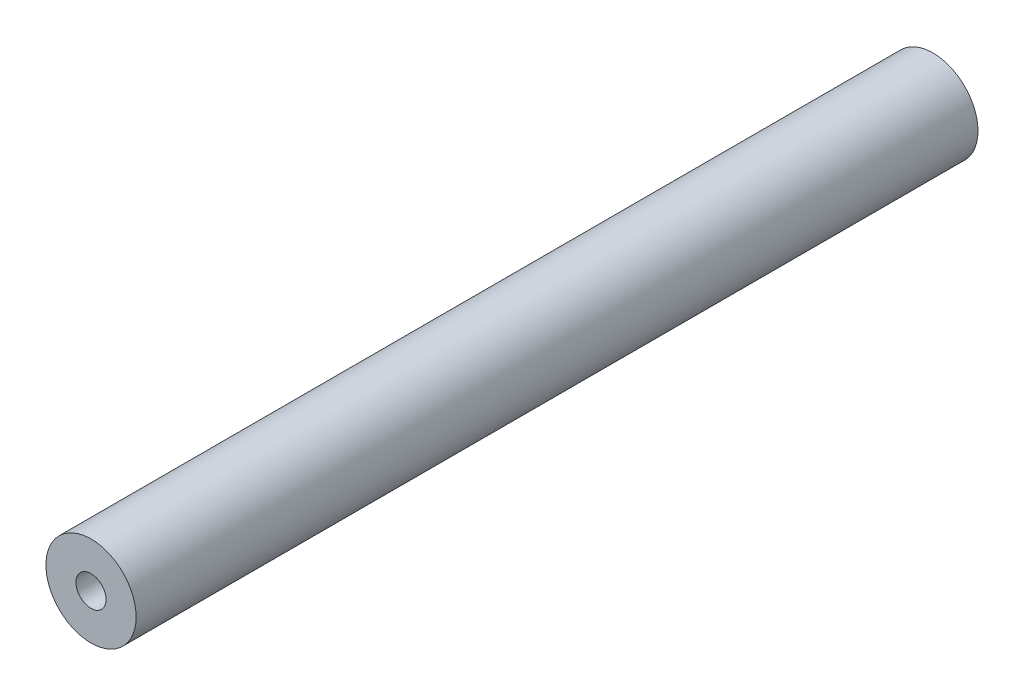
SolidWorks part; units mm, degrees
ref_plane "前视基准面" through (0, 0, 0) normal (0, 0, 1) x (1, 0, 0)
ref_plane "上视基准面" through (0, 0, 0) normal (0, 1, 0) x (1, 0, 0)
ref_plane "右视基准面" through (0, 0, 0) normal (1, 0, 0) x (0, 0, -1)
sketch "草图1" plane through (0, 0, 0) normal (0, 0, 1) x (1, 0, 0)
  circle A0 centre (0, 0) radius 7.5
extrude "凸台-拉伸1" add sketch "草图1" along normal blind 140
sketch "草图2" plane through (0, 0, 140) normal (0, 0, 1) x (1, 0, 0)
  circle A0 centre (0, 0) radius 2.5
extrude "切除-拉伸1" cut sketch "草图2" against normal blind 15
sketch "草图3" plane through (0, 0, 0) normal (0, 0, -1) x (-1, 0, 0)
  circle A0 centre (0, 0) radius 2.5
extrude "切除-拉伸2" cut sketch "草图3" against normal blind 15
